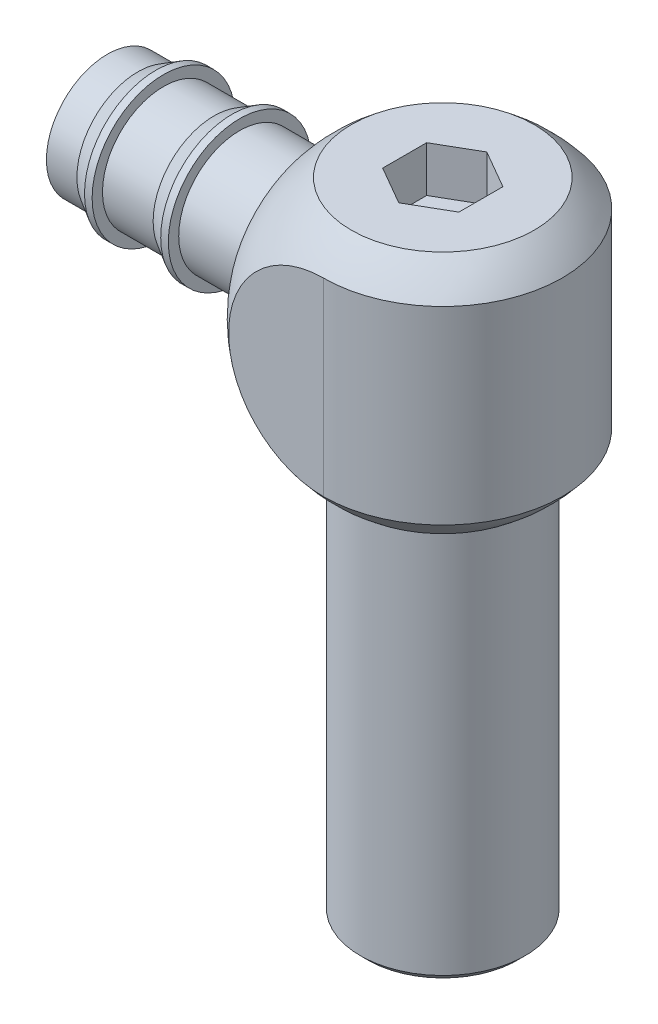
SolidWorks part; units mm, degrees
ref_plane "Front Plane" through (0, 0, 0) normal (0, 0, 1) x (1, 0, 0)
ref_plane "Top Plane" through (0, 0, 0) normal (0, 1, 0) x (1, 0, 0)
ref_plane "Right Plane" through (0, 0, 0) normal (1, 0, 0) x (0, 0, -1)
ref_plane "Plane1" through (0, 18.2626, 0) normal (0, 1, 0) x (-1, 0, 0)
sketch "Sketch1" plane through (0, 0, 0) normal (0, 0, 1) x (1, 0, 0)
  line L0 (0, 0) -> (0, 50000) construction
  line L1 (0, 34.1376) -> (0, 2.3876)
  line L2 (55, 18.2626) -> (-55, 18.2626) construction
  arc A1 (0, 2.3876) -> (0, 34.1376) centre (0, 18.2626) ccw
  dimension "D1" = 31.75
revolve "Revolve1" add sketch "Sketch1" angle 360 about L0
sketch "Sketch3" plane through (0, 0, 0) normal (0, 1, 0) x (1, 0, 0)
  line L0 (2.5806, 0) -> (50002.5806, 0) construction
  line L1 (0, -12.446) -> (-12.446, -12.446)
  line L2 (-12.446, -12.446) -> (-12.446, 12.446)
  line L3 (0, 12.446) -> (-12.446, 12.446)
  circle A0 centre (0, 0) radius 12.446 construction
  arc A1 (0, -12.446) -> (0, 12.446) centre (0, 0) ccw
  point P12 (-12.446, 0)
  dimension "D1" = 24.892
extrude "Cut-Extrude1" cut sketch "Sketch3" against normal through all and the other way through all flip side to cut
sketch "Sketch4" plane through (0, 0, 0) normal (0, 0, 1) x (1, 0, 0)
  line L0 (0, 0) -> (0, 50000) construction
  line L1 (-19.05, 30.9626) -> (19.05, 30.9626)
  line L2 (-19.05, 30.9626) -> (-19.05, 5.5626)
  line L3 (-19.05, 5.5626) -> (19.05, 5.5626)
  line L4 (19.05, 30.9626) -> (19.05, 5.5626)
  line L5 (0, 8.408) -> (0, 28.1172) construction
  line L6 (0, 18.2626) -> (50000, 18.2626) construction
  line L7 (13.6906, 18.2626) -> (-13.6906, 18.2626) construction
  point P8 (0, 18.2626)
  dimension "D1" = 25.4
  dimension "D2" = 38.1
extrude "Cut-Extrude2" cut sketch "Sketch4" against normal through all and the other way through all flip side to cut
sketch "Sketch9" plane through (0, 18.2626, 0) normal (0, 1, 0) x (1, 0, 0)
  line L0 (0, 0) -> (50000, 0) construction
  line L1 (-34.925, 0) -> (-34.925, 6.35)
  line L2 (-34.925, 6.35) -> (-31.75, 6.35)
  line L3 (-31.75, 6.35) -> (-29.8803, 7.4295)
  line L4 (-29.8803, 7.4295) -> (-29.0865, 7.4295)
  line L5 (-29.0865, 7.4295) -> (-29.0865, 6.35)
  line L6 (-29.0865, 6.35) -> (-23.8125, 6.35)
  line L7 (-23.8125, 6.35) -> (-21.9428, 7.4295)
  line L8 (-21.9428, 7.4295) -> (-21.149, 7.4295)
  line L9 (-21.149, 7.4295) -> (-21.149, 6.35)
  line L10 (-21.149, 6.35) -> (0, 6.35)
  line L11 (0, 6.35) -> (0, 0)
  line L12 (-34.925, 0) -> (0, 0)
  line L13 (0, 0) -> (0, 50000) construction
  dimension "D1" = 12.7
  dimension "D2" = 1.0795
  dimension "D4" = 23.8125
  dimension "D5" = 3.175
  dimension "D6" = 34.925
  dimension "D7" = 0.7937
  dimension "D8" = 30
revolve "Revolve2" add sketch "Sketch9" angle 360 about L0
fillet "Fillet1" radius 1.5875 1 edges at (-12.446, 18.2626, -6.35)
sketch "Sketch10" plane through (-34.925, 0, 0) normal (-1, 0, 0) x (0, 0, 1)
  circle A0 centre (0, 18.2626) radius 5.08
  circle A1 centre (0, 18.2626) radius 6.35 construction
  circle A2 centre (0, 18.2626) radius 6.35 construction
  dimension "D1" = 1.27
extrude "Cut-Extrude3" cut sketch "Sketch10" against normal up to surface (34.925 mm away)
sketch "Sketch11" plane through (0, 0, 0) normal (0, 0, 1) x (1, 0, 0)
  line L0 (0, -10.6034) -> (0, -50010.6034) construction
  line L5 (8.5725, 2.3876) -> (8.5725, 5.5626)
  line L6 (8.5725, -34.9504) -> (8.5725, 2.3876)
  line L7 (7.8105, -35.7124) -> (8.5725, -34.9504)
  line L8 (0, -35.7124) -> (7.8105, -35.7124)
  line L9 (-9.525, 5.5626) -> (9.525, 5.5626) construction
  line L10 (0, 5.5626) -> (8.5725, 5.5626)
  line L11 (0, -35.7124) -> (0, 5.5626)
  dimension "D1" = 17.145
  dimension "D2" = 3.175
  dimension "D3" = 41.275
  dimension "D4" = 0
  dimension "D5" = 45
  dimension "D6" = 0.762
revolve "Revolve3" add sketch "Sketch11" angle 360 about L0
sketch "Sketch12" plane through (0, 30.9626, 0) normal (0, 1, 0) x (1, 0, 0)
  line L0 (0, -13.6906) -> (0, 13.6906) construction
  line L1 (3.9688, 2.2914) -> (0, 4.5827)
  line L2 (0, 4.5827) -> (-3.9688, 2.2914)
  line L3 (-3.9688, 2.2914) -> (-3.9688, -2.2914)
  line L4 (-3.9688, -2.2914) -> (0, -4.5827)
  line L5 (0, -4.5827) -> (3.9688, -2.2914)
  line L6 (3.9688, -2.2914) -> (3.9688, 2.2914)
  circle A0 centre (0, 0) radius 3.9688 construction
  circle A1 centre (0, 0) radius 9.525 construction
  dimension "D1" = 7.9375
extrude "Cut-Extrude4" cut sketch "Sketch12" against normal blind 4.7625
sketch "Sketch13" plane through (0, -35.7124, 0) normal (0, -1, 0) x (1, 0, 0)
  circle A1 centre (0, 0) radius 5.5562
  circle A2 centre (0, 0) radius 8.5725 construction
  dimension "D1" = 11.1125
extrude "Cut-Extrude5" cut sketch "Sketch13" against normal blind 59.055
